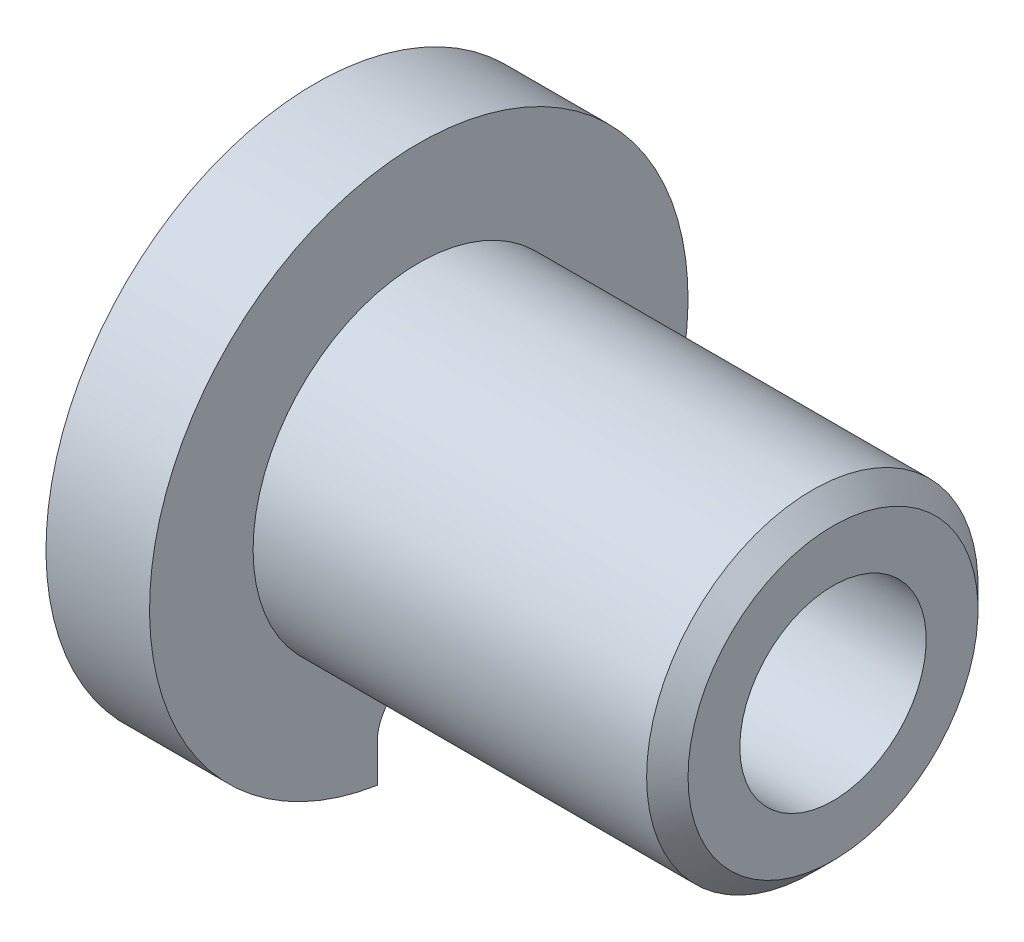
SolidWorks part; units mm, degrees
ref_plane "Plane1" through (0, 0, 0) normal (0, 0, 1) x (1, 0, 0)
ref_plane "Plane2" through (0, 0, 0) normal (0, 1, 0) x (1, 0, 0)
ref_plane "Plane3" through (0, 0, 0) normal (1, 0, 0) x (0, 0, -1)
sketch "Esquisse1" plane through (0, 0, 0) normal (0, 0, 1) x (1, 0, 0)
  line L0 (0, 0) -> (38.5536, 0) construction
  line L1 (0, 4.5) -> (25, 4.5)
  line L2 (25, 4.5) -> (25, 8)
  line L3 (25, 8) -> (5, 8)
  line L4 (5, 8) -> (5, 13)
  line L5 (5, 13) -> (0, 13)
  line L6 (0, 13) -> (0, 4.5)
revolve "Base-Révolution" add sketch "Esquisse1" angle 360 about L0
chamfer "Chanfrein2" distance 1 angle 45
sketch "Esquisse2" plane through (0, 0, 0) normal (-1, 0, 0) x (0, 0, 1)
  line L0 (0, 20.0822) -> (0, -15.0208) construction
  line L1 (-17.8029, 0) -> (22.8814, 0) construction
  line L2 (2, -11) -> (2, -12.8452)
  line L3 (-2, -11) -> (-2, -12.8452)
  arc A0 (2, -11) -> (-2, -11) centre (0, -11) ccw
  arc A1 (-2, -12.8452) -> (2, -12.8452) centre (0, 0) ccw
extrude "Enlèv. mat.-Extru.1" cut sketch "Esquisse2" against normal through all
equation "\"diam_ext@Esquisse2\" = 2 * \"rayon_ext@Esquisse1\""
